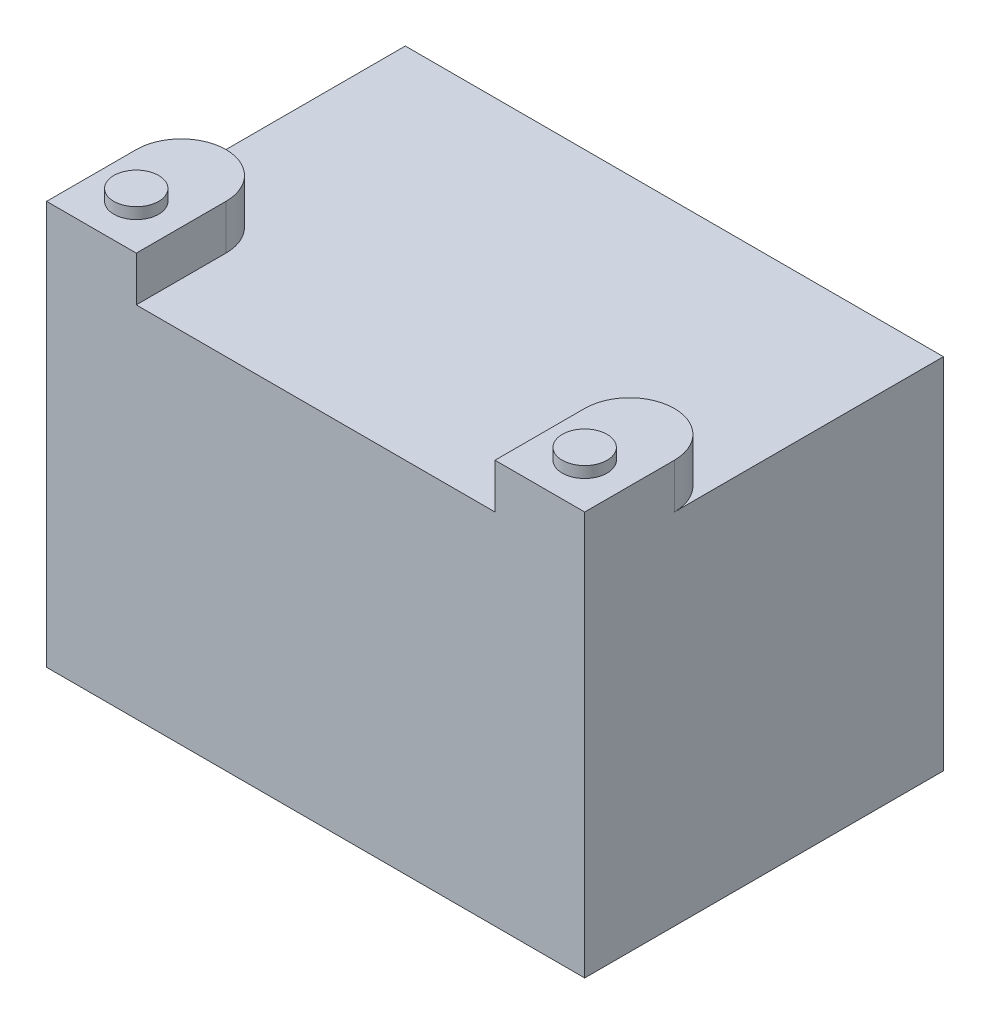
SolidWorks part; units mm, degrees
ref_plane "Front Plane" through (0, 0, 0) normal (0, 0, 1) x (1, 0, 0)
ref_plane "Top Plane" through (0, 0, 0) normal (0, 1, 0) x (1, 0, 0)
ref_plane "Right Plane" through (0, 0, 0) normal (1, 0, 0) x (0, 0, -1)
sketch "Sketch1" plane through (0, 0, 0) normal (0, 1, 0) x (1, 0, 0)
  line L1 (0, 0) -> (152.4, 0)
  line L2 (0, 0) -> (0, 101.6)
  line L3 (0, 101.6) -> (152.4, 101.6)
  line L4 (152.4, 0) -> (152.4, 101.6)
  dimension "D1" = 152.4
  dimension "D2" = 101.6
extrude "Boss-Extrude1" add sketch "Sketch1" along normal blind 101.6
sketch "Sketch2" plane through (0, 101.6, 0) normal (0, 1, 0) x (1, 0, 0)
  line L1 (0, 0) -> (25.4, 0)
  line L2 (0, 0) -> (0, 25.4)
  line L4 (25.4, 0) -> (25.4, 25.4)
  line L5 (152.4, 0) -> (127, 0)
  line L6 (152.4, 0) -> (152.4, 25.4)
  line L8 (127, 0) -> (127, 25.4)
  arc A0 (25.4, 25.4) -> (0, 25.4) centre (12.7, 25.4) ccw
  arc A1 (152.4, 25.4) -> (127, 25.4) centre (139.7, 25.4) ccw
  point P12 (139.7, 38.1)
  point P13 (12.7, 0)
  point P14 (12.7, 38.1)
  dimension "D5" = 12.7
  dimension "D6" = 12.7
  dimension "D1" = 25.4
  dimension "D2" = 25.4
  dimension "D3" = 25.4
  dimension "D4" = 25.4
  dimension "D7" = 38.1
  dimension "D8" = 38.1
extrude "Boss-Extrude2" add sketch "Sketch2" along normal blind 12.7
sketch "Sketch3" plane through (0, 114.3, 0) normal (0, 1, 0) x (1, 0, 0)
  line L0 (76.2, 0) -> (76.2, 179.3508) construction
  line L1 (25.4, 0) -> (127, 0) construction
  line L2 (0, 25.4) -> (0, 0) construction
  line L3 (0, 0) -> (25.4, 0) construction
  circle A0 centre (12.7, 12.7) radius 6.35
  circle A2 centre (139.7, 12.7) radius 6.35
  dimension "D3" = 12.7
  dimension "D1" = 12.7
  dimension "D2" = 12.7
extrude "Boss-Extrude3" add sketch "Sketch3" along normal blind 3.175
